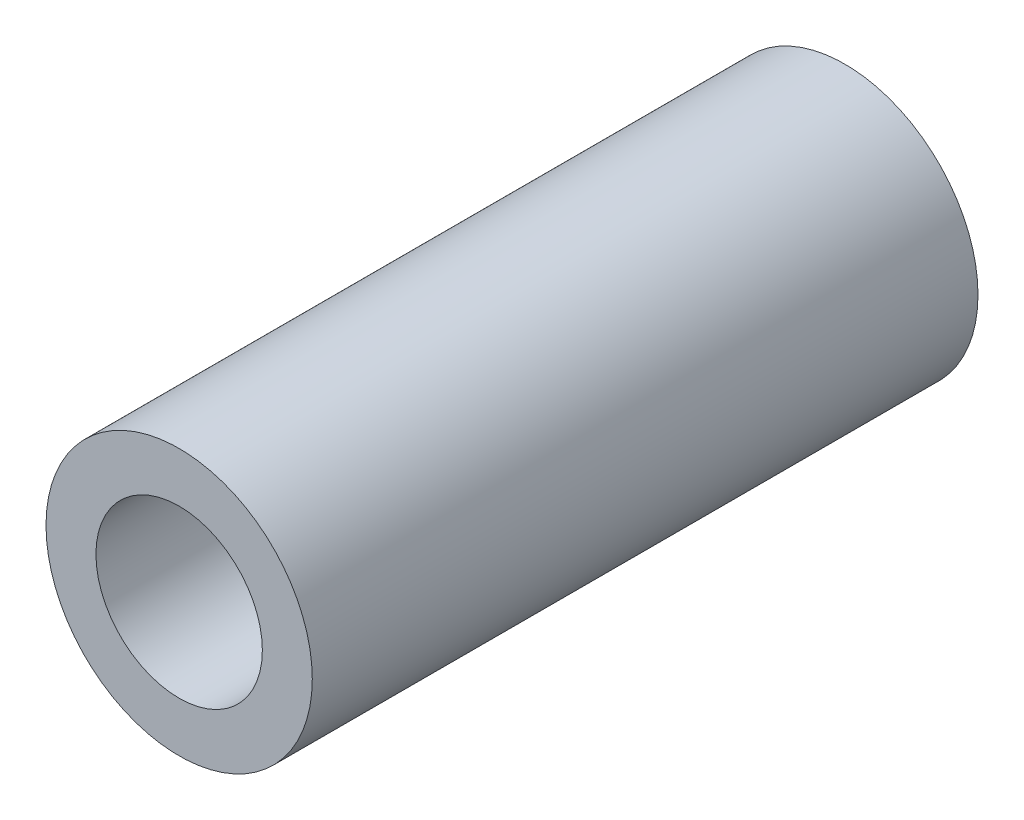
SolidWorks part; units mm, degrees
ref_plane "Front Plane" through (0, 0, 0) normal (0, 0, 1) x (1, 0, 0)
ref_plane "Top Plane" through (0, 0, 0) normal (0, 1, 0) x (1, 0, 0)
ref_plane "Right Plane" through (0, 0, 0) normal (1, 0, 0) x (0, 0, -1)
sketch "Sketch1" plane through (0, 0, 0) normal (0, 0, 1) x (1, 0, 0)
  circle A0 centre (0, 0) radius 5.08
extrude "Boss-Extrude1" add sketch "Sketch1" along normal blind 25.4
sketch "Sketch2" plane through (0, 0, 25.4) normal (0, 0, 1) x (1, 0, 0)
  circle A0 centre (0, 0) radius 3.175
extrude "Cut-Extrude1" cut sketch "Sketch2" against normal blind 25.4 contours A0
